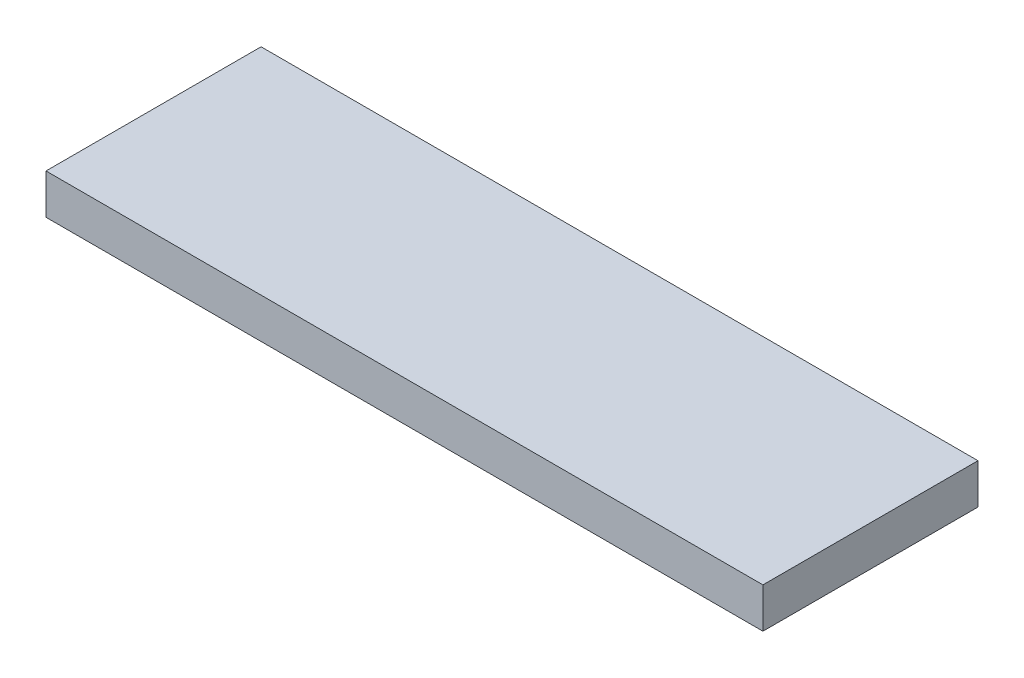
SolidWorks part; units mm, degrees
ref_plane "Front Plane" through (0, 0, 0) normal (0, 0, 1) x (1, 0, 0)
ref_plane "Top Plane" through (0, 0, 0) normal (0, 1, 0) x (1, 0, 0)
ref_plane "Right Plane" through (0, 0, 0) normal (1, 0, 0) x (0, 0, -1)
sketch "Sketch2" plane through (0, 0, 0) normal (0, 1, 0) x (1, 0, 0)
  line L1 (0, 0) -> (50, 0)
  line L2 (0, 0) -> (0, 15)
  line L3 (0, 15) -> (50, 15)
  line L4 (50, 0) -> (50, 15)
extrude "Boss-Extrude1" add sketch "Sketch2" along normal blind 2.8
